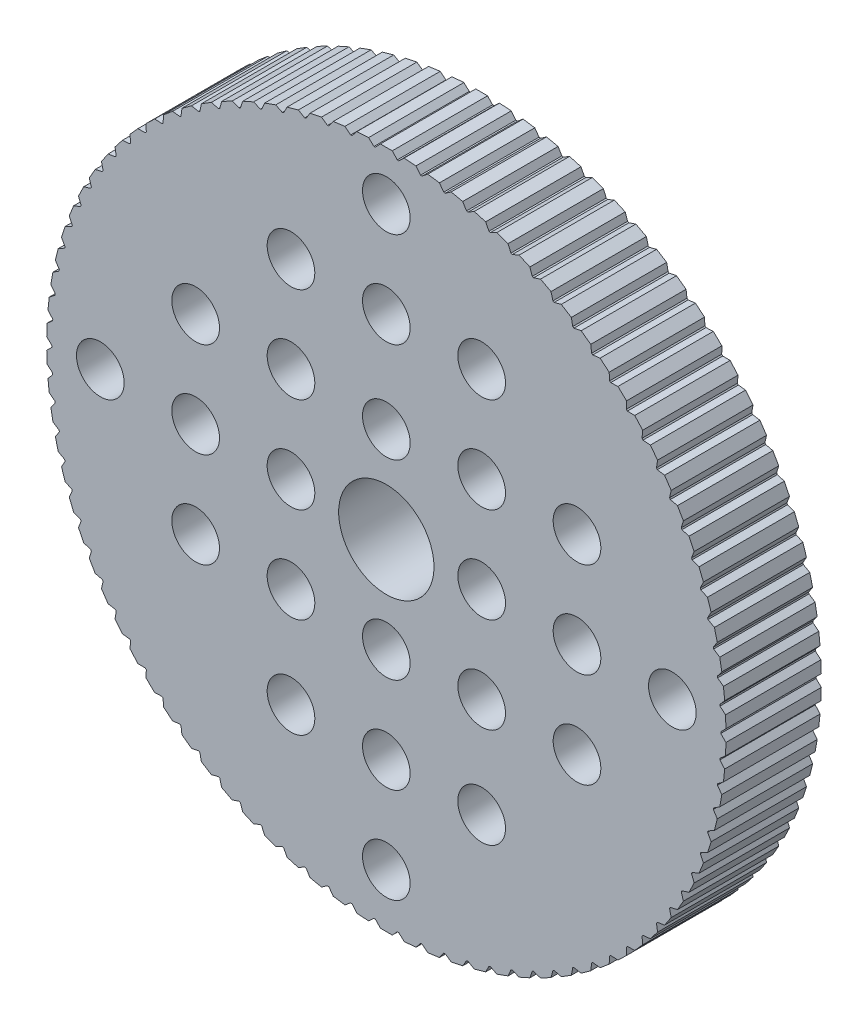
SolidWorks part; units mm, degrees
ref_plane "前视基准面" through (0, 0, 0) normal (0, 0, 1) x (1, 0, 0)
ref_plane "上视基准面" through (0, 0, 0) normal (0, 1, 0) x (1, 0, 0)
ref_plane "右视基准面" through (0, 0, 0) normal (1, 0, 0) x (0, 0, -1)
sketch "草图1" plane through (0, 0, 0) normal (0, 0, 1) x (1, 0, 0)
  line L7 (0.9772, 27.9829) -> (1.4916, 28.4609)
  line L8 (2.9268, 27.8466) -> (2.4839, 28.3915)
  line L9 (1.4916, 28.4609) -> (2.4839, 28.3915)
  circle A2 centre (0, 0) radius 4
  arc A3 (2.9268, 27.8466) -> (-2.9268, -27.8466) centre (0, 0) cw
  arc A4 (0.9772, 27.9829) -> (-2.9268, -27.8466) centre (-0.0632, 0.0044) ccw
extrude "凸台-拉伸1" add sketch "草图1" along normal blind 8
pattern_circular "阵列(圆周)1" count 90 over 360 about axis through (0, 0, 0) along (0, 0, 1) of "凸台-拉伸1"
sketch "草图2" plane through (0, 0, 0) normal (0, 0, 1) x (1, 0, 0)
  circle A0 centre (8, 0.3751) radius 2
  circle A1 centre (16, 0.3751) radius 2
  circle A2 centre (24, 0.3751) radius 2
  circle A3 centre (-8, 0.3751) radius 2
  circle A4 centre (-16, 0.3751) radius 2
  circle A5 centre (-24, 0.3751) radius 2
  circle A7 centre (0, 8) radius 2
  circle A8 centre (0, 16.3751) radius 2
  circle A9 centre (0, 24.3751) radius 2
  circle A13 centre (0, -8) radius 2
  circle A14 centre (0, -16) radius 2
  circle A16 centre (0, -24) radius 2
  circle A17 centre (0, -8) radius 2
  circle A19 centre (-16, 8.3751) radius 2
  circle A20 centre (-8, 8.3751) radius 2
  circle A21 centre (-16, -7.6249) radius 2
  circle A22 centre (-8, -7.6249) radius 2
  circle A23 centre (8, -7.6249) radius 2
  circle A24 centre (16, -7.6249) radius 2
  circle A25 centre (8, 8.3751) radius 2
  circle A26 centre (16, 8.3751) radius 2
  circle A27 centre (8, -16) radius 2
  circle A28 centre (8, 16.3751) radius 2
  circle A29 centre (-8, -16) radius 2
  circle A30 centre (-8, 16.3751) radius 2
  point P3 (0, 0)
  point P35 (0, 0)
extrude "切除-拉伸2" cut sketch "草图2" along normal blind 77 contours A14 | A27 | A4 | A19 | A13 | A24 | A1 | A2 | A7 | A28 | A5 | A21 | A29 | A16 | A22 | A3 | A23 | A0 | A26 | A25 | A20 | A30 | A8 | A9
